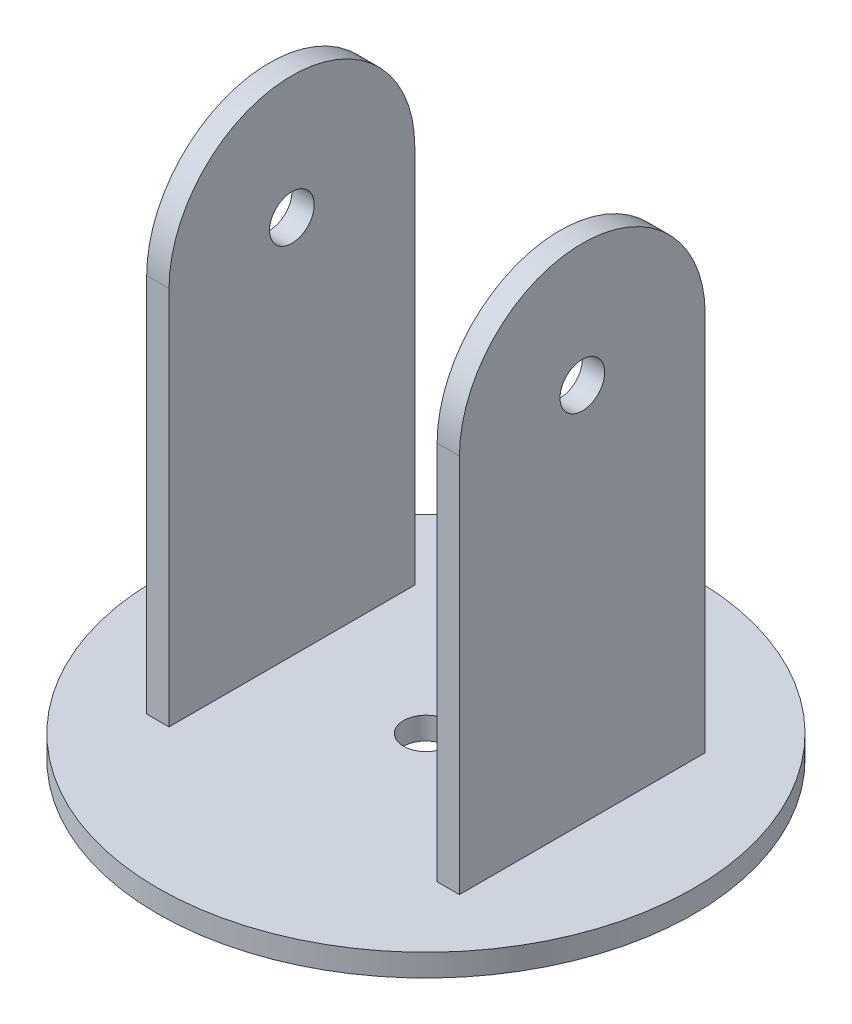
SolidWorks part; units mm, degrees
ref_plane "Front Plane" through (0, 0, 0) normal (0, 0, 1) x (1, 0, 0)
ref_plane "Top Plane" through (0, 0, 0) normal (0, 1, 0) x (1, 0, 0)
ref_plane "Right Plane" through (0, 0, 0) normal (1, 0, 0) x (0, 0, -1)
sketch "Sketch2" plane through (0, 0, 0) normal (0, 1, 0) x (1, 0, 0)
  circle A0 centre (0, 0) radius 60
extrude "Boss-Extrude2" add sketch "Sketch2" along normal blind 5
ref_plane "Plane1" through (35, 0, 0) normal (1, 0, 0) x (0, 0, -1)
sketch "Sketch3" plane through (35, 0, 0) normal (1, 0, 0) x (0, 0, -1)
  line L0 (-27.5, 0) -> (27.5, 0)
  line L1 (-27.5, 0) -> (-27.5, 90)
  line L2 (0, 2.75) -> (0, -2.75) construction
  line L3 (27.5, 0) -> (27.5, 90)
  arc A0 (-27.5, 90) -> (27.5, 90) centre (0, 90) cw
  point P4 (0, 0)
  dimension "D1" = 55
  dimension "D2" = 90
extrude "Boss-Extrude3" add sketch "Sketch3" against normal blind 5
mirror "Mirror1" about plane through (0, 0, 0) normal (1, 0, 0) of "Boss-Extrude3"
sketch "Sketch4" plane through (35, 0, 0) normal (1, 0, 0) x (0, 0, -1)
  circle A0 centre (0, 90) radius 5
extrude "Cut-Extrude1" cut sketch "Sketch4" against normal through all
sketch "Sketch5" plane through (0, 5, 0) normal (0, 1, 0) x (1, 0, 0)
  circle A0 centre (0, 0) radius 5
extrude "Cut-Extrude2" cut sketch "Sketch5" against normal blind 5
